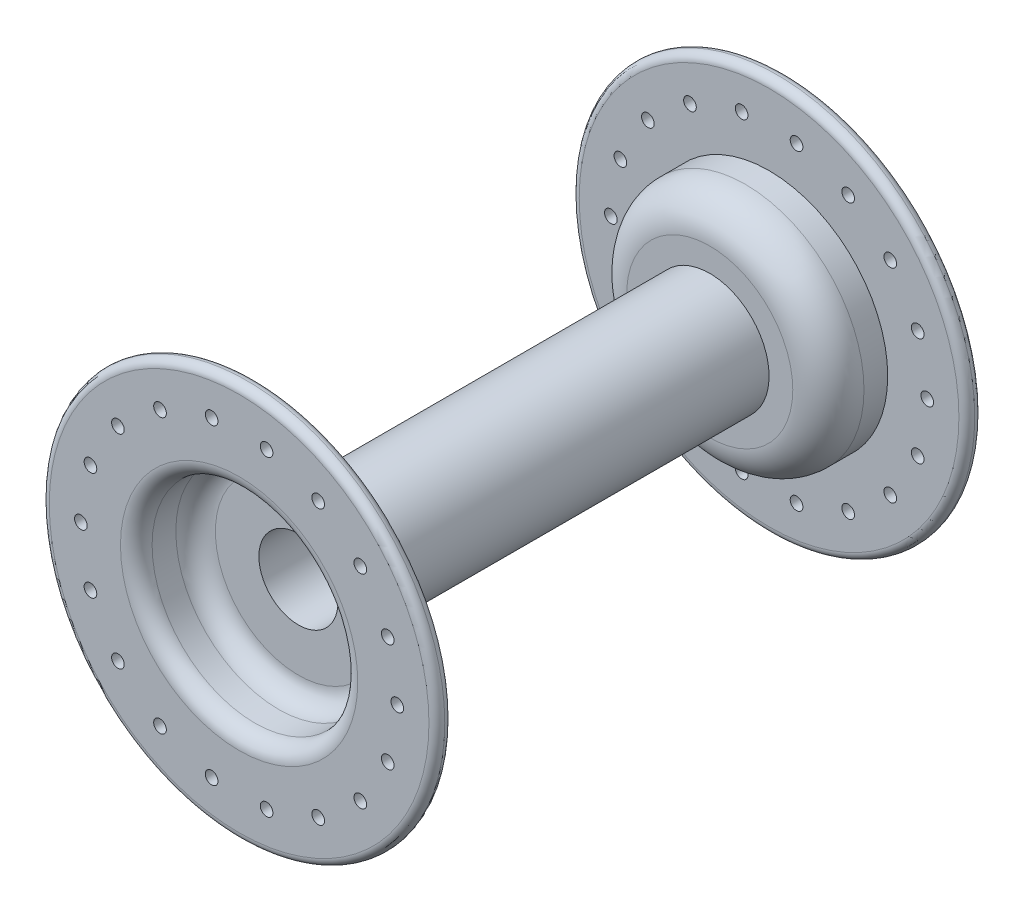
SolidWorks part; units mm, degrees
ref_plane "Front Plane" through (0, 0, 0) normal (0, 0, 1) x (1, 0, 0)
ref_plane "Top Plane" through (0, 0, 0) normal (0, 1, 0) x (1, 0, 0)
ref_plane "Right Plane" through (0, 0, 0) normal (1, 0, 0) x (0, 0, -1)
sketch "Sketch1" plane through (0, 0, 0) normal (0, 0, 1) x (1, 0, 0)
  circle A0 centre (0, 0) radius 7.5
  dimension "D1" = 15
extrude "Boss-Extrude1" add sketch "Sketch1" along normal mid plane 50
sketch "Sketch6" plane through (0, 0, 0) normal (1, 0, 0) x (0, 0, -1)
  line L0 (-32.5, 15) -> (-29.5, 15)
  line L2 (-27, 0) -> (-25, 0)
  line L4 (0, 0) -> (0, 22.3477) construction
  line L5 (0, 8.25) -> (0, -8.25) construction
  line L6 (-25, 0) -> (-25, 10.5)
  line L8 (-27, 0) -> (-27, 10.5)
  line L9 (-25, 0) -> (-25, 22.3477) construction
  line L10 (-32.5, 15) -> (-32.5, 13)
  line L11 (-30.5, 13) -> (-29.5, 13) construction
  line L12 (-27, 2) -> (-27, 10.5) construction
  line L13 (-32.5, 13) -> (-29.5, 13)
  line L14 (-30.5, 13) -> (-30.5, 2) construction
  line L15 (-30.5, 2) -> (-27, 2) construction
  line L16 (-32.5, 15) -> (-32.5, 0) construction
  line L17 (-32.5, 0) -> (-25, 0) construction
  arc A0 (-29.5, 15) -> (-25, 10.5) centre (-29.5, 10.5) cw
  arc A1 (-29.5, 13) -> (-27, 10.5) centre (-29.5, 10.5) cw
  dimension "D2" = 25
  dimension "D1" = 3
  dimension "D3" = 15
  dimension "D4" = 32.5
  dimension "D5" = 2
revolve "Revolve1" add sketch "Sketch6" angle 360
sketch "Sketch2" plane through (0, 0, 32.5) normal (0, 0, 1) x (1, 0, 0)
  circle A0 centre (0, 0) radius 25
  circle A2 centre (0, 0) radius 13
  dimension "D1" = 50
  dimension "D2" = 26
extrude "Boss-Extrude2" add sketch "Sketch2" along normal blind 2
fillet "Fillet3" radius 1
sketch "Sketch5" plane through (0, 0, 34.5) normal (0, 0, 1) x (1, 0, 0)
  line L0 (0, 0) -> (20, 0) construction
  circle A0 centre (0, 0) radius 20 construction
  circle A1 centre (20, 0) radius 0.8
  dimension "D1" = 40
  dimension "D2" = 1.6
extrude "Cut-Extrude3" cut sketch "Sketch5" against normal up to next
pattern_circular "CirPattern1" count 18 over 360 of "Cut-Extrude3"
mirror "Mirror1" about plane through (0, 0, 0) normal (0, 0, 1) of "CirPattern1", "Fillet3", "Boss-Extrude2", "Revolve1"
sketch "Sketch7" plane through (0, 0, 34.5) normal (0, 0, 1) x (1, 0, 0)
  circle A0 centre (0, 0) radius 5
  dimension "D1" = 10
extrude "Cut-Extrude4" cut sketch "Sketch7" against normal through all
fillet "Fillet4" radius 2
